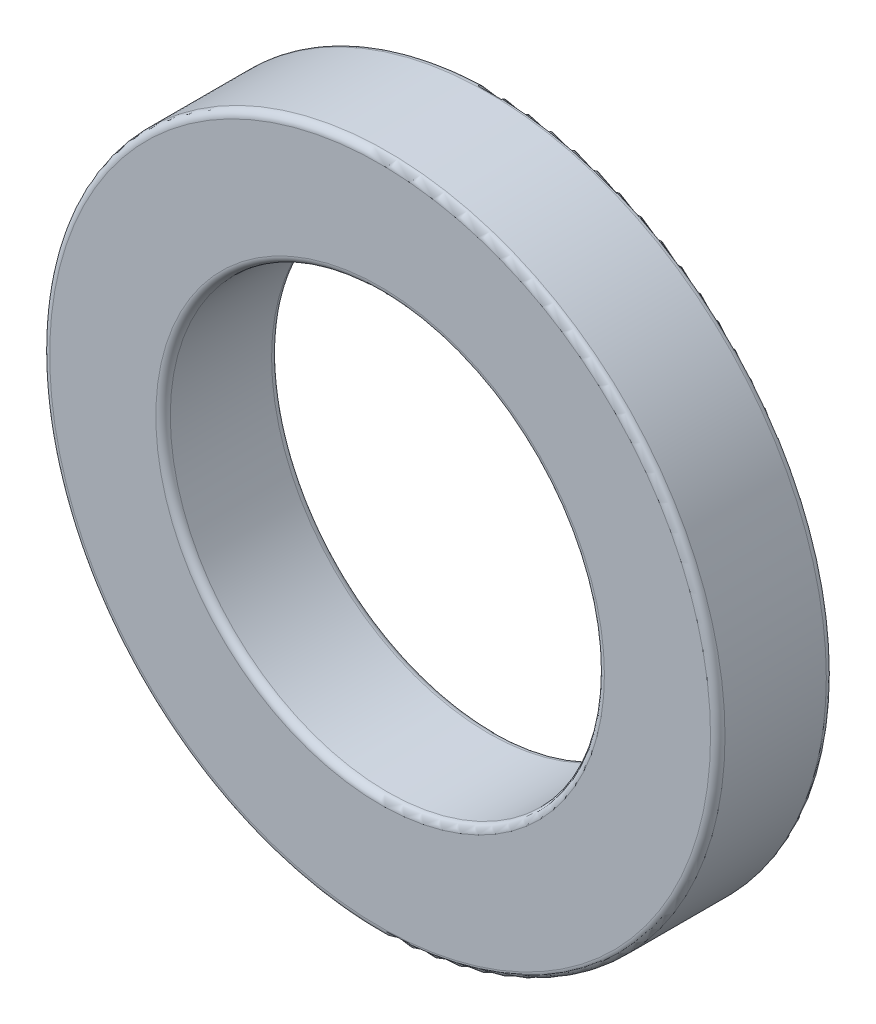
SolidWorks part; units mm, degrees
ref_plane "Face" through (0, 0, 0) normal (0, 0, 1) x (1, 0, 0)
ref_plane "Dessus" through (0, 0, 0) normal (0, 1, 0) x (1, 0, 0)
ref_plane "Droite" through (0, 0, 0) normal (1, 0, 0) x (0, 0, -1)
sketch "E_corps" plane through (0, 0, 0) normal (1, 0, 0) x (0, 0, -1)
  line L0 (-33.1757, 0) -> (55.1783, 0) construction
  line L1 (1.5, 70) -> (22.5, 70)
  line L2 (24, 68.5) -> (24, 46.5)
  line L3 (22.5, 45) -> (1.5, 45)
  line L4 (0, 46.5) -> (0, 68.5)
  line L5 (0, 50) -> (0, -50) construction
  arc A0 (0, 68.5) -> (1.5, 70) centre (1.5, 68.5) cw
  arc A1 (24, 68.5) -> (22.5, 70) centre (22.5, 68.5) ccw
  arc A2 (1.5, 45) -> (0, 46.5) centre (1.5, 46.5) cw
  arc A3 (24, 46.5) -> (22.5, 45) centre (22.5, 46.5) cw
  dimension "Rayon" = 1.5
  dimension "Rayon3" = 1.5
  dimension "Rayon1" = 1.5
  dimension "Rayon2" = 1.5
  dimension "Largeur" = 24
  dimension "Diamètre_nominal" = 90
  dimension "Diamètre_extérieur" = 140
revolve "corps" add sketch "E_corps" angle 360 about L0
sketch "E_symbole" plane through (0, 0, 0) normal (1, 0, 0) x (0, 0, -1)
  line L0 (-3.4482, 57.5) -> (19.8356, 57.5) construction
  line L1 (-33.1757, 0) -> (55.1783, 0) construction
  line L2 (2.4, 57.495) -> (2.4, 57.505)
  line L3 (2.4, 57.505) -> (11.995, 57.505)
  line L4 (2.4, 57.495) -> (11.995, 57.495)
  line L5 (11.995, 57.505) -> (11.995, 63.75)
  line L6 (11.995, 57.495) -> (11.995, 51.25)
  line L7 (11.995, 63.75) -> (12.005, 63.75)
  line L8 (11.995, 51.25) -> (12.005, 51.25)
  line L9 (12, 16.6578) -> (12, 5.8829) construction
  line L10 (12.005, 57.505) -> (12.005, 63.75)
  line L11 (21.6, 57.505) -> (12.005, 57.505)
  line L12 (21.6, 57.495) -> (21.6, 57.505)
  line L13 (21.6, 57.495) -> (12.005, 57.495)
  line L14 (12.005, 57.495) -> (12.005, 51.25)
  line L15 (24, 68.5) -> (24, 46.5) construction
  line L17 (1.5, 70) -> (22.5, 70) construction
  line L18 (0, 46.5) -> (0, 68.5) construction
  line L19 (-8.3118, 0) -> (25.8663, 0) construction
  point P7 (2.4, 57.5)
  point P16 (12, 51.25)
  point P17 (12, 63.75)
  dimension "D1" = 57.5
  dimension "D2" = 2.4
  dimension "D3" = 0.01
  dimension "D4" = 0.01
  dimension "D5" = 6.25
  dimension "D6" = 12
other "Symbole" parameters "D1"=360, "D3"=0.01, "D4"=1, "D7"=0
equation "\"Rayon3@E_corps\" = \"Rayon@E_corps\""
equation "\"Rayon2@E_corps\" = \"Rayon@E_corps\""
equation "\"Rayon1@E_corps\" = \"Rayon@E_corps\""
equation "\"D1@E_symbole\" = (\"Diamètre_nominal@E_corps\"+\"Diamètre_extérieur@E_corps\")/4"
equation "\"D2@E_symbole\" = 0.1*\"Largeur@E_corps\""
equation "\"D4@E_symbole\" = \"D3@E_symbole\""
equation "\"D5@E_symbole\" =   ( ( \"Diamètre_extérieur@E_corps\" - \"Diamètre_nominal@E_corps\")/2 )  * 0.25"
equation "\"D6@E_symbole\" = 0.5*\"Largeur@E_corps\""
